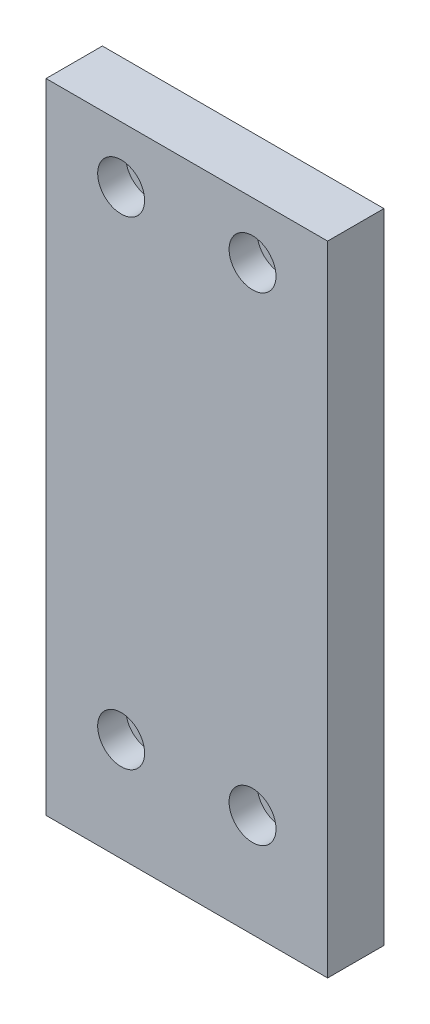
SolidWorks part; units mm, degrees
ref_plane "Front Plane" through (0, 0, 0) normal (0, 0, 1) x (1, 0, 0)
ref_plane "Top Plane" through (0, 0, 0) normal (0, 1, 0) x (1, 0, 0)
ref_plane "Right Plane" through (0, 0, 0) normal (1, 0, 0) x (0, 0, -1)
sketch "Sketch1" plane through (0, 0, 0) normal (0, 1, 0) x (1, 0, 0)
  line L1 (0, 0) -> (95.25, 0)
  line L2 (0, 0) -> (0, 19.05)
  line L3 (0, 19.05) -> (95.25, 19.05)
  line L4 (95.25, 0) -> (95.25, 19.05)
  dimension "D1" = 95.25
  dimension "D2" = 19.05
extrude "Extrude1" add sketch "Sketch1" along normal blind 215.9
hole_wizard "3/8-16 Tapped Hole1" positions "Sketch3" profile "Sketch2" tap size "3/8-16" standard "Example Inch"
sketch "Sketch3" plane through (0, 0, 0) normal (0, -1, 0) x (1, 0, 0)
  line L0 (47.625, -19.05) -> (47.625, -6.7792) construction
  line L1 (95.25, -19.05) -> (0, -19.05) construction
  line L3 (0, -19.05) -> (0, 0) construction
  point P0 (9.525, -9.525)
  point P1 (85.725, -9.525)
  point P13 (0, -9.525)
  dimension "D1" = 76.2
sketch "Sketch2" plane through (9.525, 0, -9.525) normal (1, 0, 0) x (0, 0, -1)
  line L0 (0, 0) -> (0, 29.3087)
  line L1 (0, 29.3087) -> (3.9687, 26.924)
  line L2 (3.9687, 26.924) -> (3.9687, 0)
  line L5 (3.9687, 0) -> (0, 0)
  line L10 (0, 29.3087) -> (-3.9688, 26.924) construction
  line L11 (0, -6.35) -> (0, 107.95) construction
  dimension "Tap Drill Dia." = 7.9375
  dimension "Tap Drill Depth" = 26.924
  dimension "Drill Angle" = 118
hole_wizard "CBORE for 3/8 Socket Head Cap Screw1" positions "Sketch5" profile "Sketch4" counterbore size "3/8" standard "Example Inch"
sketch "Sketch5" plane through (0, 0, 0) normal (0, 0, 1) x (1, 0, 0)
  line L0 (47.625, 0) -> (47.625, 55.5629) construction
  line L1 (0, 0) -> (95.25, 0) construction
  line L3 (14.9031, 115.8875) -> (57.9014, 115.8875) construction
  point P0 (25.4, 34.925)
  point P1 (69.85, 34.925)
  point P3 (69.85, 196.85)
  point P5 (25.4, 196.85)
  dimension "D1" = 44.45
  dimension "D2" = 161.925
  dimension "D3" = 34.925
sketch "Sketch4" plane through (25.4, 34.925, 0) normal (1, 0, 0) x (0, -1, 0)
  line L0 (0, 0) -> (0, 19.05)
  line L1 (0, 19.05) -> (5.0419, 19.05)
  line L3 (5.0419, 19.05) -> (5.0419, 9.525)
  line L4 (5.0419, 9.525) -> (7.9375, 9.525)
  line L5 (7.9375, 9.525) -> (7.9375, 0)
  line L7 (7.9375, 0) -> (0, 0)
  line L11 (0, -6.35) -> (0, 107.95) construction
  dimension "Thru Hole Dia." = 10.0838
  dimension "Thru Hole Depth" = 19.05
  dimension "C'Bore Dia." = 15.875
  dimension "C'Bore Depth" = 9.525
